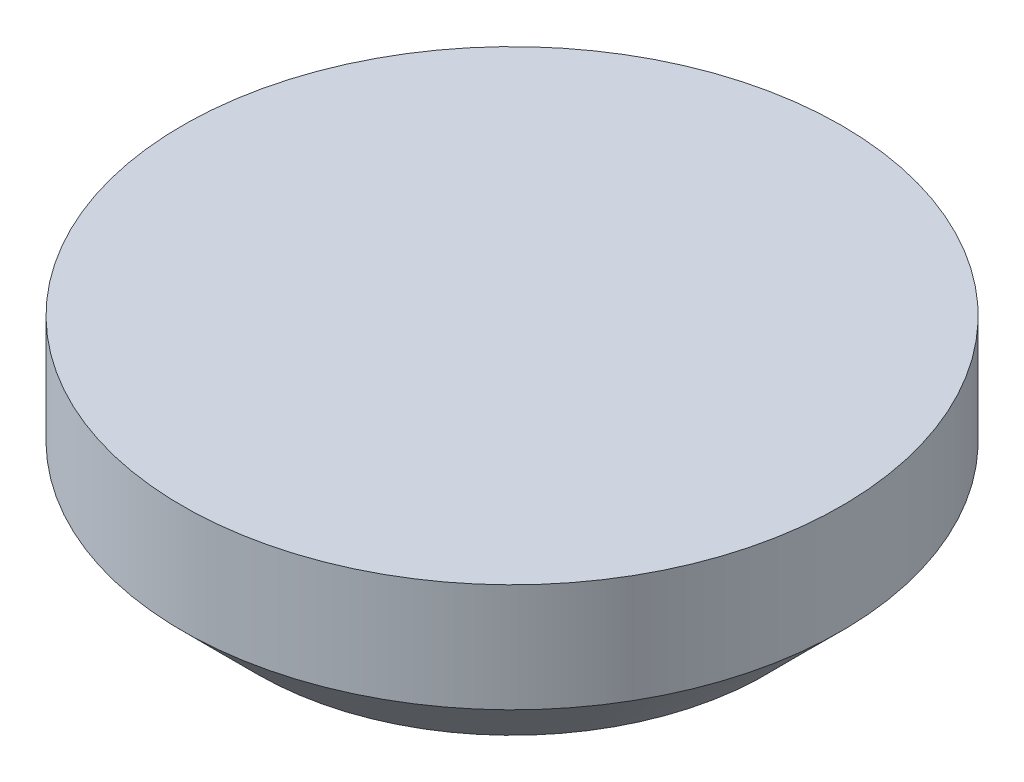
SolidWorks part; units mm, degrees
ref_plane "前视基准面" through (0, 0, 0) normal (0, 0, 1) x (1, 0, 0)
ref_plane "上视基准面" through (0, 0, 0) normal (0, 1, 0) x (1, 0, 0)
ref_plane "右视基准面" through (0, 0, 0) normal (1, 0, 0) x (0, 0, -1)
sketch "草图1" plane through (0, 0, 0) normal (0, 0, 1) x (1, 0, 0)
  line L0 (0, 0) -> (0, 528.9135) construction
  line L1 (0, 390) -> (700, 390)
  line L2 (700, 390) -> (700, 160)
  line L3 (700, 160) -> (540, 0)
  line L4 (540, 0) -> (0, 0)
  line L5 (0, 0) -> (0, 390)
  dimension "D1" = 230
  dimension "D2" = 160
  dimension "D3" = 1400
  dimension "D4" = 1080
revolve "旋转1" add sketch "草图1" angle 360 about L0
